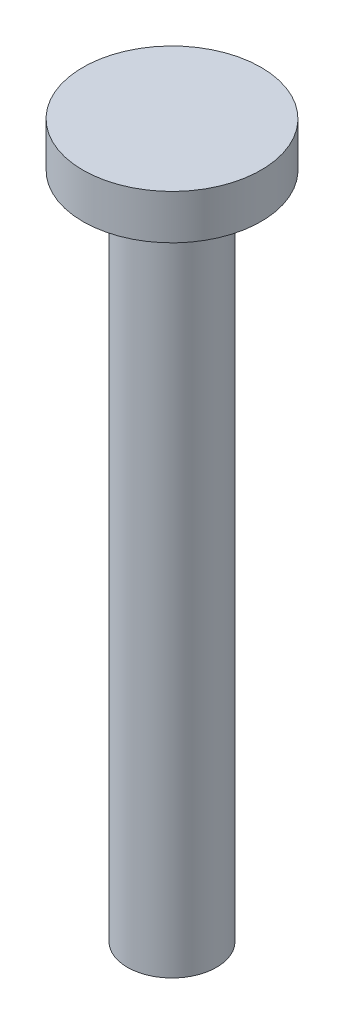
SolidWorks part; units mm, degrees
ref_plane "Ebene vorne" through (0, 0, 0) normal (0, 0, 1) x (1, 0, 0)
ref_plane "Ebene oben" through (0, 0, 0) normal (0, 1, 0) x (1, 0, 0)
ref_plane "Ebene rechts" through (0, 0, 0) normal (1, 0, 0) x (0, 0, -1)
sketch "Skizze1" plane through (0, 0, 0) normal (0, 1, 0) x (1, 0, 0)
  circle A0 centre (0, 0) radius 1
extrude "Linear austragen1" add sketch "Skizze1" along normal blind 15
sketch "Skizze2" plane through (0, 15, 0) normal (0, 1, 0) x (-1, 0, 0)
  circle A0 centre (0, 0) radius 2
extrude "Linear austragen2" add sketch "Skizze2" along normal blind 1
